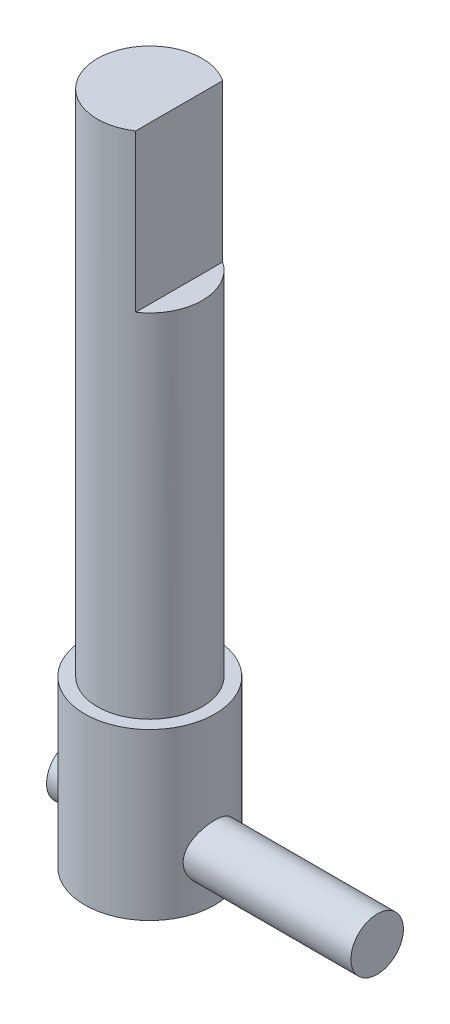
SolidWorks part; units mm, degrees
ref_plane "Front Plane" through (0, 0, 0) normal (0, 0, 1) x (1, 0, 0)
ref_plane "Top Plane" through (0, 0, 0) normal (0, 1, 0) x (1, 0, 0)
ref_plane "Right Plane" through (0, 0, 0) normal (1, 0, 0) x (0, 0, -1)
sketch "Sketch1" plane through (0, 0, 0) normal (0, 0, 1) x (1, 0, 0)
  line L0 (0, 0) -> (0, 99.8664) construction
  line L1 (0, 0) -> (-3.937, 0)
  line L2 (-3.937, 0) -> (-3.937, 10.0076)
  line L3 (-3.937, 10.0076) -> (-3.175, 10.0076)
  line L4 (-3.175, 10.0076) -> (-3.175, 40.7924)
  line L5 (-3.175, 40.7924) -> (0, 40.7924)
  line L6 (0, 40.7924) -> (0, 0)
  dimension "D1" = 7.874
  dimension "D2" = 6.35
  dimension "D3" = 40.7924
  dimension "D4" = 10.0076
revolve "Revolve1" add sketch "Sketch1" angle 360 about L0
sketch "Sketch2" plane through (0, 40.7924, 0) normal (0, 1, 0) x (1, 0, 0)
  line L0 (1.778, 6.0984) -> (1.778, -6.0984)
  line L1 (-3.175, 0) -> (1.778, 0) construction
  arc A0 (1.778, -6.0984) -> (1.778, 6.0984) centre (0, 0) ccw
  circle A1 centre (0, 0) radius 3.175 construction
  dimension "D1" = 4.953
extrude "Cut-Extrude1" cut sketch "Sketch2" against normal blind 9.4996
sketch "Sketch3" plane through (0, 0, 0) normal (1, 0, 0) x (0, 0, -1)
  line L0 (0, 4.445) -> (0, 0) construction
  circle A0 centre (0, 2.8575) radius 1.5875
  dimension "D1" = 3.175
  dimension "D2" = 4.445
extrude "Boss-Extrude1" add sketch "Sketch3" along normal blind 13.7541 and the other way blind 4.6609
